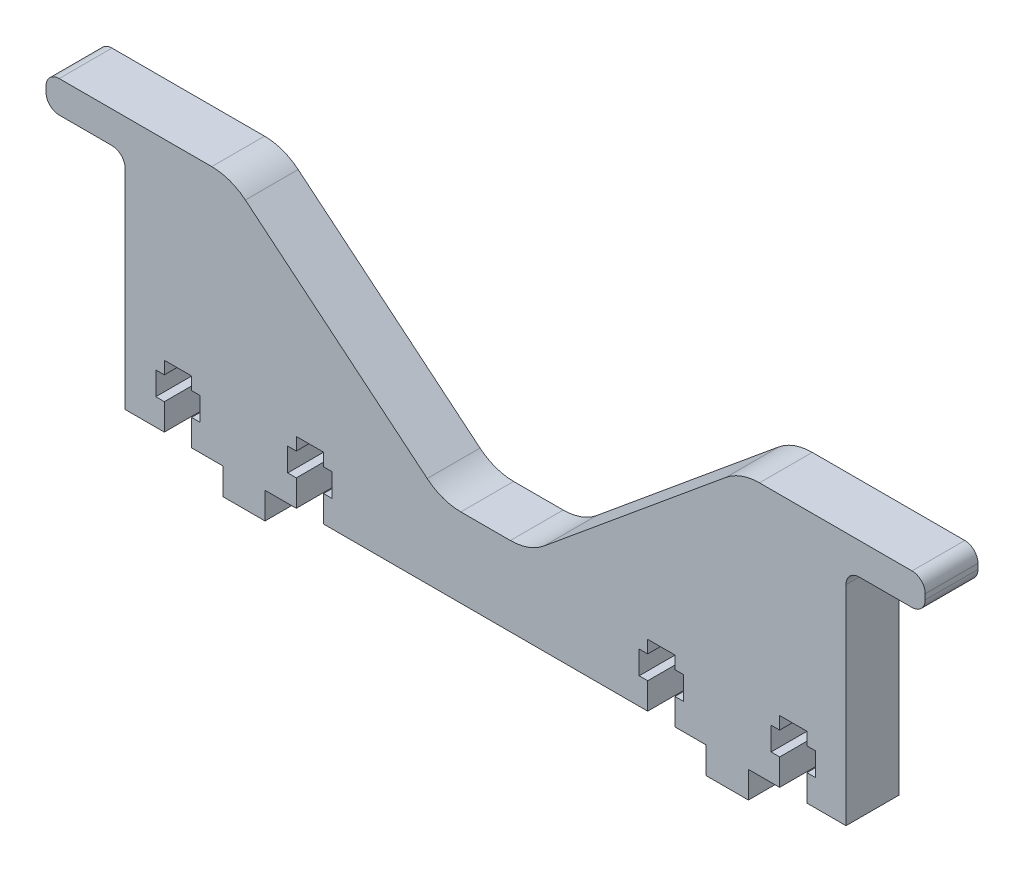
SolidWorks part; units mm, degrees
ref_plane "Front Plane" through (0, 0, 0) normal (0, 0, 1) x (1, 0, 0)
ref_plane "Top Plane" through (0, 0, 0) normal (0, 1, 0) x (1, 0, 0)
ref_plane "Right Plane" through (0, 0, 0) normal (1, 0, 0) x (0, 0, -1)
sketch "Sketch1" plane through (0, 0, 0) normal (0, 0, 1) x (1, 0, 0)
  line L0 (86.726, 0) -> (86.726, 53.4145)
  line L2 (0, -38.2429) -> (0, 108.2287) construction
  line L3 (86.726, 53.4145) -> (105.776, 53.4145)
  line L4 (61.326, 61.0345) -> (10.526, 19.05)
  line L5 (10.526, 19.05) -> (-10.526, 19.05)
  line L6 (86.726, 0) -> (-86.726, 0)
  line L8 (96.251, 53.3891) -> (96.251, 58.2151) construction
  line L9 (105.776, 53.4145) -> (105.776, 61.0345)
  line L10 (105.776, 61.0345) -> (61.326, 61.0345)
  line L11 (-61.326, 61.0345) -> (-10.526, 19.05)
  line L12 (-96.251, 53.3891) -> (-96.251, 58.2151) construction
  line L13 (-105.776, 61.0345) -> (-61.326, 61.0345)
  line L14 (-105.776, 53.4145) -> (-105.776, 61.0345)
  line L15 (-86.726, 53.4145) -> (-105.776, 53.4145)
  line L16 (-86.726, 0) -> (-86.726, 53.4145)
  point P29 (0, 19.05)
  point P32 (0, 0)
  dimension "D1" = 0.0254
  dimension "D2" = 7.62
  dimension "D3" = 19.05
  dimension "D4" = 25.4
  dimension "D5" = 19.05
  dimension "D6" = 50.8
  dimension "D7" = 173.452
  dimension "D8" = 53.4145
extrude "Boss-Extrude1" add sketch "Sketch1" against normal blind 12.7
sketch "Sketch2" plane through (-86.726, 0, 0) normal (-1, 0, 0) x (0, 0, 1)
  line L0 (-6.35, 0) -> (-6.35, 53.4145) construction
  line L1 (-12.7, 0) -> (0, 0) construction
  line L2 (-12.7, 53.4145) -> (0, 53.4145) construction
ref_plane "Plane1" through (0, 0, -6.35) normal (0, 0, 1) x (0, 1, 0)
fillet "Fillet1" radius 12.7 4 edges at (-61.326, 61.0345, -6.35) (-10.526, 19.05, -6.35) (10.526, 19.05, -6.35) (61.326, 61.0345, -6.35)
fillet "Fillet2" radius 3.175 6 edges at (-86.726, 53.4145, -6.35) (-105.776, 53.4145, -6.35) (-105.776, 61.0345, -6.35) (86.726, 53.4145, -6.35) (105.776, 53.4145, -6.35) (105.776, 61.0345, -6.35)
sketch "Sketch3" plane through (0, 0, 0) normal (0, 0, 1) x (1, 0, 0)
  line L0 (80.376, 0) -> (80.376, 61.0345) construction
  line L1 (-86.726, 0) -> (86.726, 0) construction
  line L2 (102.601, 61.0345) -> (65.8949, 61.0345) construction
  line L3 (86.726, 0) -> (86.726, 50.2395) construction
  line L4 (0, 0) -> (0, 19.05) construction
  line L5 (5.9571, 19.05) -> (-5.9571, 19.05) construction
  circle A0 centre (80.376, 44.5245) radius 3.25
  circle A1 centre (-80.376, 44.5245) radius 3.25
  point P12 (84.2479, 61.0345)
  dimension "D2" = 6.5
  dimension "D1" = 6.35
  dimension "D4" = 3.8719
  dimension "D5" = 16.51
extrude "Cut-Extrude1" cut sketch "Sketch3" against normal through all
sketch "Sketch4" plane through (0, 0, 0) normal (0, 0, 1) x (1, 0, 0)
  line L0 (86.726, 30.4704) -> (80.376, 30.4704)
  line L1 (86.726, 0) -> (86.726, 50.2395) construction
  line L2 (80.376, 30.4704) -> (80.376, 32.5786)
  line L3 (80.376, 32.5786) -> (74.788, 32.5786)
  line L4 (74.788, 32.5786) -> (74.788, 30.4704)
  line L5 (87.349, 27.1954) -> (65.603, 27.1954) construction
  line L6 (86.194, 27.1954) -> (88.504, 27.1954) construction
  line L7 (74.788, 30.4704) -> (67.168, 30.4704)
  line L8 (67.168, 30.4704) -> (67.168, 23.9204)
  line L9 (80.376, 22.1954) -> (80.376, 32.1954) construction
  line L10 (74.788, 23.9204) -> (67.168, 23.9204)
  line L11 (74.788, 21.8122) -> (74.788, 23.9204)
  line L12 (80.376, 21.8122) -> (74.788, 21.8122)
  line L13 (80.376, 23.9204) -> (80.376, 21.8122)
  line L14 (86.726, 23.9204) -> (80.376, 23.9204)
  line L15 (86.726, 30.4704) -> (86.726, 23.9204)
  line L16 (74.026, -5.449) -> (74.026, 16.2645) construction
  line L17 (74.026, -4.294) -> (74.026, -6.604) construction
  line L18 (74.026, 61.0345) -> (74.026, 2.7085) construction
  line L19 (77.3026, 0) -> (77.3026, 6.35)
  line L20 (-86.726, 0) -> (86.726, 0) construction
  line L21 (77.3026, 6.35) -> (79.36, 6.35)
  line L22 (79.36, 6.35) -> (79.36, 11.938)
  line L23 (79.36, 11.938) -> (77.3026, 11.938)
  line L24 (77.3026, 11.938) -> (77.3026, 14.986)
  line L25 (77.3026, 14.986) -> (70.7494, 14.986)
  line L26 (70.7494, 0) -> (70.7494, 6.35)
  line L27 (70.7494, 11.938) -> (70.7494, 14.986)
  line L28 (68.692, 11.938) -> (70.7494, 11.938)
  line L29 (68.692, 6.35) -> (68.692, 11.938)
  line L30 (70.7494, 6.35) -> (68.692, 6.35)
  line L31 (77.3026, 0) -> (70.7494, 0)
  line L32 (69.026, 6.35) -> (79.026, 6.35) construction
  line L33 (0, 0) -> (0, 77.6155) construction
  line L34 (-74.026, -5.449) -> (-74.026, 16.2645) construction
  line L35 (-87.349, 27.1954) -> (-65.603, 27.1954) construction
  line L36 (-77.3026, 0) -> (-70.7494, 0)
  line L37 (-70.7494, 6.35) -> (-68.692, 6.35)
  line L38 (-68.692, 6.35) -> (-68.692, 11.938)
  line L39 (-68.692, 11.938) -> (-70.7494, 11.938)
  line L40 (-70.7494, 11.938) -> (-70.7494, 14.986)
  line L41 (-70.7494, 0) -> (-70.7494, 6.35)
  line L42 (-77.3026, 14.986) -> (-70.7494, 14.986)
  line L43 (-77.3026, 11.938) -> (-77.3026, 14.986)
  line L44 (-79.36, 11.938) -> (-77.3026, 11.938)
  line L45 (-79.36, 6.35) -> (-79.36, 11.938)
  line L46 (-77.3026, 6.35) -> (-79.36, 6.35)
  line L47 (-77.3026, 0) -> (-77.3026, 6.35)
  line L48 (-86.726, 30.4704) -> (-86.726, 23.9204)
  line L49 (-86.726, 23.9204) -> (-80.376, 23.9204)
  line L50 (-80.376, 23.9204) -> (-80.376, 21.8122)
  line L51 (-80.376, 21.8122) -> (-74.788, 21.8122)
  line L52 (-74.788, 21.8122) -> (-74.788, 23.9204)
  line L53 (-74.788, 23.9204) -> (-67.168, 23.9204)
  line L54 (-67.168, 30.4704) -> (-67.168, 23.9204)
  line L55 (-74.788, 30.4704) -> (-67.168, 30.4704)
  line L56 (-74.788, 32.5786) -> (-74.788, 30.4704)
  line L57 (-80.376, 32.5786) -> (-74.788, 32.5786)
  line L58 (-80.376, 30.4704) -> (-80.376, 32.5786)
  line L59 (-86.726, 30.4704) -> (-80.376, 30.4704)
  line L60 (58.151, 0) -> (58.151, 22.5979) construction
  line L61 (38.9994, 0) -> (45.5526, 0)
  line L62 (45.5526, 6.35) -> (47.61, 6.35)
  line L63 (47.61, 6.35) -> (47.61, 11.938)
  line L64 (47.61, 11.938) -> (45.5526, 11.938)
  line L65 (45.5526, 11.938) -> (45.5526, 14.986)
  line L66 (45.5526, 0) -> (45.5526, 6.35)
  line L67 (38.9994, 14.986) -> (45.5526, 14.986)
  line L68 (38.9994, 11.938) -> (38.9994, 14.986)
  line L69 (36.942, 11.938) -> (38.9994, 11.938)
  line L70 (36.942, 6.35) -> (36.942, 11.938)
  line L71 (38.9994, 6.35) -> (36.942, 6.35)
  line L72 (38.9994, 0) -> (38.9994, 6.35)
  line L73 (42.276, 14.986) -> (42.276, 0) construction
  line L74 (-42.276, 14.986) -> (-42.276, 0) construction
  line L75 (-38.9994, 0) -> (-38.9994, 6.35)
  line L76 (-38.9994, 6.35) -> (-36.942, 6.35)
  line L77 (-36.942, 6.35) -> (-36.942, 11.938)
  line L78 (-36.942, 11.938) -> (-38.9994, 11.938)
  line L79 (-38.9994, 11.938) -> (-38.9994, 14.986)
  line L80 (-38.9994, 14.986) -> (-45.5526, 14.986)
  line L81 (-45.5526, 0) -> (-45.5526, 6.35)
  line L82 (-45.5526, 11.938) -> (-45.5526, 14.986)
  line L83 (-47.61, 11.938) -> (-45.5526, 11.938)
  line L84 (-47.61, 6.35) -> (-47.61, 11.938)
  line L85 (-45.5526, 6.35) -> (-47.61, 6.35)
  line L86 (-38.9994, 0) -> (-45.5526, 0)
  point P18 (67.168, 27.1954)
  point P37 (74.026, 14.986)
  point P74 (-74.026, 14.986)
  point P75 (-67.168, 27.1954)
  point P90 (42.276, 14.986)
  dimension "D1" = 3.275
  dimension "D2" = 2.1082
  dimension "D3" = 5.588
  dimension "D4" = 7.62
  dimension "D5" = 5.588
  dimension "D6" = 3.2766
  dimension "D7" = 5.334
  dimension "D8" = 3.048
  dimension "D9" = 31.75
extrude "Cut-Extrude2" cut sketch "Sketch4" against normal through all
sketch "Sketch6" plane through (0, 0, 0) normal (0, 0, 1) x (1, 0, 0)
  line L0 (-53.071, 0) -> (-53.071, -6.4008)
  line L1 (-70.7494, 0) -> (-45.5526, 0) construction
  line L2 (-53.071, -6.4008) -> (-63.231, -6.4008)
  line L3 (-63.231, -6.4008) -> (-63.231, 0)
  line L4 (-63.231, 0) -> (-53.071, 0)
  line L5 (-47.61, 9.144) -> (-68.692, 9.144) construction
  line L6 (-47.61, 11.938) -> (-47.61, 6.35) construction
  line L7 (-68.692, 6.35) -> (-68.692, 11.938) construction
  line L8 (-58.151, 9.144) -> (-58.151, 2.0953) construction
  line L9 (-58.151, -6.4008) -> (-58.151, 0) construction
  line L10 (0, 0) -> (0, 10.4728) construction
  line L11 (-38.9994, 0) -> (38.9994, 0) construction
  line L12 (58.151, -6.4008) -> (58.151, 0) construction
  line L13 (63.231, 0) -> (53.071, 0)
  line L14 (63.231, -6.4008) -> (63.231, 0)
  line L15 (53.071, -6.4008) -> (63.231, -6.4008)
  line L16 (53.071, 0) -> (53.071, -6.4008)
  dimension "D1" = 6.4008
  dimension "D2" = 10.16
extrude "Boss-Extrude2" add sketch "Sketch6" against normal blind 12.7
sketch "Sketch7" plane through (0, 0, 0) normal (0, 0, 1) x (1, 0, 0)
  line L0 (-86.726, 0) -> (-86.726, 53.4145) construction
  line L1 (-86.726, 36.3975) -> (-65.6635, 36.3975)
  line L2 (-86.726, 36.3975) -> (-86.726, 19.9886)
  line L3 (-86.726, 19.9886) -> (-65.6635, 19.9886)
  line L4 (-65.6635, 36.3975) -> (-65.6635, 19.9886)
  line L5 (86.726, 0) -> (86.726, 23.9204) construction
  line L6 (64.0151, 36.3975) -> (86.726, 36.3975)
  line L7 (64.0151, 36.3975) -> (64.0151, 17.2803)
  line L8 (64.0151, 17.2803) -> (86.726, 17.2803)
  line L9 (86.726, 36.3975) -> (86.726, 17.2803)
  circle A0 centre (-80.376, 44.5245) radius 4.3176
  circle A1 centre (80.376, 44.5245) radius 5.1695
extrude "Boss-Extrude3" add sketch "Sketch7" against normal up to surface (12.7 mm away)
